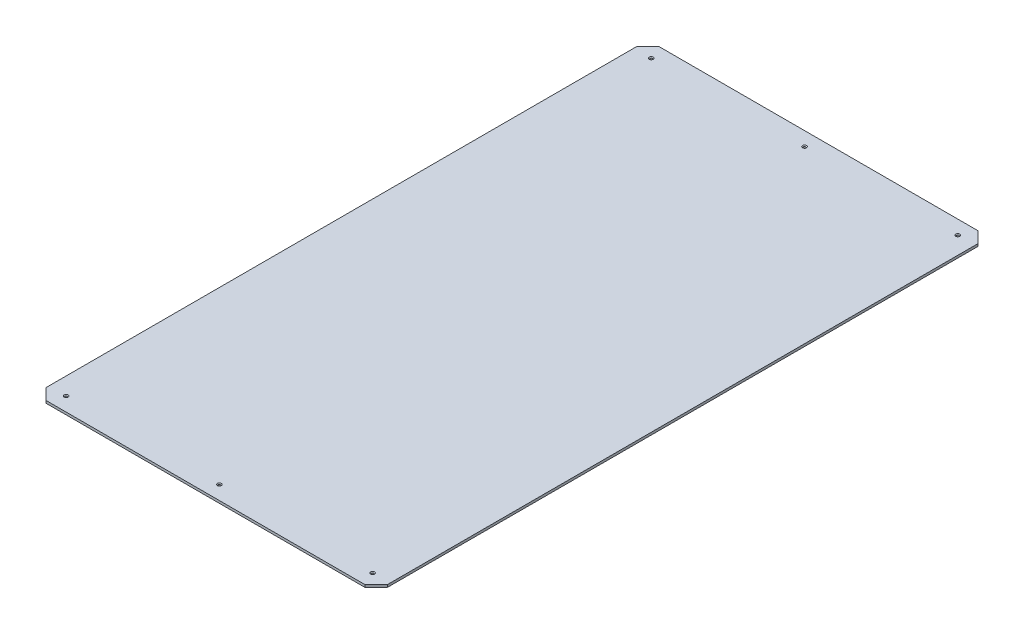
SolidWorks part; units mm, degrees
ref_plane "Front Plane" through (0, 0, 0) normal (0, 0, 1) x (1, 0, 0)
ref_plane "Top Plane" through (0, 0, 0) normal (0, 1, 0) x (1, 0, 0)
ref_plane "Right Plane" through (0, 0, 0) normal (1, 0, 0) x (0, 0, -1)
sketch "Sketch1" plane through (0, 0, 0) normal (0, 1, 0) x (1, 0, 0)
  line L1 (245, -440) -> (-245, -440)
  line L2 (245, -440) -> (245, 440)
  line L3 (245, 440) -> (-245, 440)
  line L4 (-245, -440) -> (-245, 440)
  line L5 (245, -440) -> (-245, 440) construction
  line L6 (245, 440) -> (-245, -440) construction
  point P0 (0, 0)
  dimension "D1" = 490
  dimension "垫板宽" = 880
sheet metal parameters "Sheet-Metal1" thickness 3.5 parameters "D1"=1
base flange "Base-Flange1" sketch "Sketch1" thickness 3.5 reverse thickness direction no parameters "D1"=1
break corner "Break-Corner1" thickness 3.5 parameters "D1"=16, "D7"=5
sketch "Sketch4" plane through (0, 0, 0) normal (0, 1, 0) x (1, 0, 0)
  line L0 (229, 440) -> (-229, 440) construction
  line L1 (220, -420) -> (-220, -420)
  line L2 (220, -420) -> (220, 420)
  line L3 (220, 420) -> (-220, 420)
  line L4 (-220, -420) -> (-220, 420)
  line L5 (220, -420) -> (-220, 420) construction
  line L6 (220, 420) -> (-220, -420) construction
  line L7 (245, -424) -> (245, 424) construction
  point P0 (0, 0)
  point P10 (0, 420)
  point P11 (0, -420)
  dimension "D1" = 20
  dimension "D2" = 25
hole_wizard "CSK for #4 Flat Head Machine Screw (100)1" positions "Sketch6" profile "Sketch7" countersink size "#4" standard "Ansi Inch"
sketch "Sketch6" plane through (0, 0, 0) normal (0, 1, 0) x (-1, 0, 0)
  point P0 (220, -420)
  point P1 (0, -420)
  point P4 (-220, -420)
  point P7 (220, 420)
  point P10 (0, 420)
  point P13 (-220, 420)
sketch "Sketch7" plane through (-220, 0, -420) normal (1, 0, 0) x (0, 0, 1)
  line L0 (0, 0) -> (0, 3.5)
  line L1 (0, 3.5) -> (1.6319, 3.5)
  line L2 (1.6319, 3.5) -> (1.6319, 1.0284)
  line L3 (1.6319, 1.0284) -> (2.8575, 0)
  line L5 (2.8575, 0) -> (0, 0)
  line L6 (-1.6319, 1.0284) -> (-2.8575, 0) construction
  line L11 (0, -6.35) -> (0, 107.95) construction
  dimension "Thru Hole Dia." = 3.2639
  dimension "Thru Hole Depth" = 3.5
  dimension "Near C'Sink Dia." = 5.715
  dimension "Near C'Sink Angle" = 100
flat pattern "Flat-Pattern1"
sketch "Bend-Lines1" plane through (0, 0, 0) normal (0, 1, 0) x (-1, 0, 0)
sketch3d "Bounding-Box1" [suppressed]
  line L0 (0, 0, 0) -> (0, 880, 0) construction
  line L1 (490, 0, 0) -> (490, 880, 0) construction
  line L2 (0, 0, 0) -> (490, 0, 0) construction
  line L3 (0, 880, 0) -> (490, 880, 0) construction
sketch "Sketch9" plane through (0, 0, 0) normal (0, 1, 0) x (1, 0, 0)
  line L0 (229, 440) -> (-229, 440) construction
  line L1 (220, -420) -> (-220, -420)
  line L2 (220, -420) -> (220, 420)
  line L3 (220, 420) -> (-220, 420)
  line L4 (-220, -420) -> (-220, 420)
  line L5 (220, -420) -> (-220, 420) construction
  line L6 (220, 420) -> (-220, -420) construction
  line L7 (245, -424) -> (245, 424) construction
  point P0 (0, 0)
  point P10 (0, 420)
  point P11 (0, -420)
  dimension "D1" = 20
  dimension "D2" = 25
